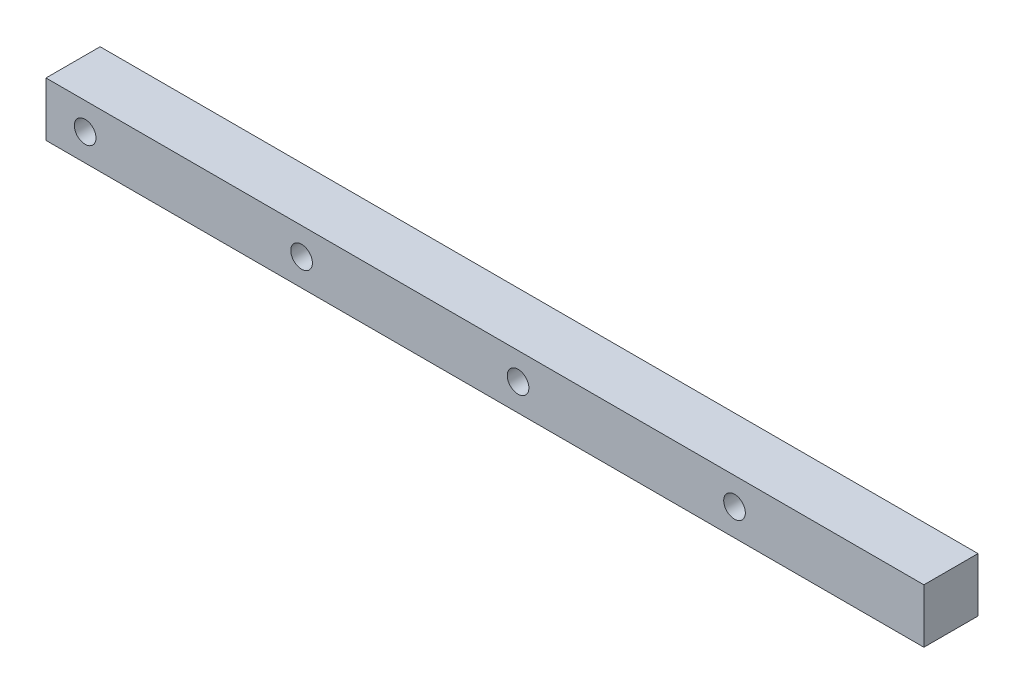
SolidWorks part; units mm, degrees
ref_plane "Plan de face" through (0, 0, 0) normal (0, 0, 1) x (1, 0, 0)
ref_plane "Plan de dessus" through (0, 0, 0) normal (0, 1, 0) x (1, 0, 0)
ref_plane "Plan de droite" through (0, 0, 0) normal (1, 0, 0) x (0, 0, -1)
sketch "Esquisse1" plane through (0, 0, 0) normal (0, 0, 1) x (1, 0, 0)
  line L1 (0, 0) -> (162.23, 0)
  line L2 (0, 0) -> (0, 10)
  line L3 (0, 10) -> (162.23, 10)
  line L4 (162.23, 0) -> (162.23, 10)
  dimension "D1" = 162.23
  dimension "D2" = 10
extrude "Boss.-Extru.1" add sketch "Esquisse1" along normal blind 10
sketch "Esquisse2" plane through (0, 0, 10) normal (0, 0, 1) x (1, 0, 0)
  circle A0 centre (7.2342, 5) radius 2
  dimension "D1" = 4
extrude "Enlèv. mat.-Extru.1" cut sketch "Esquisse2" against normal blind 10
pattern_linear "Répétition linéaire1" count 4 spacing 40 along (1, 0, 0) of "Enlèv. mat.-Extru.1"
